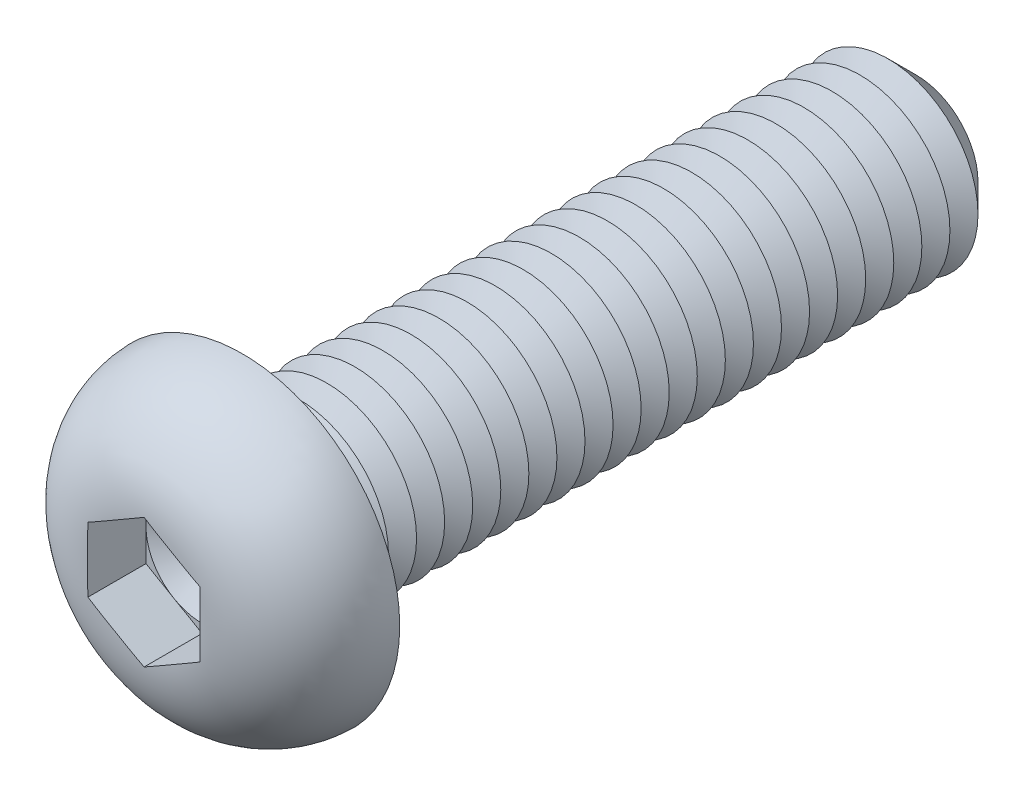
SolidWorks part; units mm, degrees
ref_plane "Front Plane" through (0, 0, 0) normal (0, 0, 1) x (1, 0, 0)
ref_plane "Top Plane" through (0, 0, 0) normal (0, 1, 0) x (1, 0, 0)
ref_plane "Right Plane" through (0, 0, 0) normal (1, 0, 0) x (0, 0, -1)
sketch "Sketch1" plane through (0, 0, 0) normal (1, 0, 0) x (0, 0, -1)
  line L0 (-47.9342, 0) -> (60.3146, 0) construction
sketch "Sketch2" plane through (0, 0, 0) normal (1, 0, 0) x (0, 0, -1)
  line L0 (0, 0) -> (-4.4, 0)
  line L1 (-47.9342, 0) -> (60.3146, 0) construction
  line L2 (-4.4, 0) -> (-4.4, 2.5011)
  line L3 (0, 7) -> (0, 0)
  arc A0 (-4.4, 2.5011) -> (0, 7) centre (0.1, 2.5011) cw
  dimension "D1" = 4.5
  dimension "D2" = 4.4
  dimension "D3" = 7
revolve "Revolve1" add sketch "Sketch2" angle 360 about L0
sketch "Sketch3" plane through (0, 0, 4.4) normal (0, 0, 1) x (1, 0, 0)
  line L1 (0, 2.8868) -> (-2.5, 1.4434)
  line L2 (-2.5, 1.4434) -> (-2.5, -1.4434)
  line L3 (-2.5, -1.4434) -> (0, -2.8868)
  line L4 (0, -2.8868) -> (2.5, -1.4434)
  line L5 (2.5, -1.4434) -> (2.5, 1.4434)
  line L6 (2.5, 1.4434) -> (0, 2.8868)
  circle A0 centre (0, 0) radius 2.5 construction
  dimension "D1" = 5
extrude "Cut-Extrude1" cut sketch "Sketch3" against normal blind 2.6
sketch "Sketch4" plane through (0, 0, 0) normal (0, 0, -1) x (-1, 0, 0)
  circle A0 centre (0, 0) radius 4
  dimension "D1" = 8
extrude "Boss-Extrude1" add sketch "Sketch4" along normal blind 30
chamfer "Chamfer1" distance 1.25 angle 45 1 edges at (-4, 0, -30)
sketch "Sketch5" plane through (0, 0, 0) normal (1, 0, 0) x (0, 0, -1)
  line L0 (1.25, 4) -> (2.5, 4)
  line L1 (28.75, 4) -> (0, 4) construction
  line L2 (2.5, 4) -> (1.875, 2.9175)
  line L3 (1.875, 2.9175) -> (1.25, 4)
  line L4 (0, -7) -> (0, 7) construction
  line L5 (28.75, 4) -> (0, 4) construction
  dimension "D1" = 1.25
  dimension "D2" = 1.25
revolve "Cut-Revolve1" cut sketch "Sketch5" angle 360 about L0
pattern_linear "LPattern1" count 22 spacing 1.25 along (0, 0, -1) of "Cut-Revolve1"
fillet "Fillet2" radius 0.5 1 edges at (4, 0, 0)
sketch "Sketch6" plane through (0, 0, 1.8) normal (0, 0, 1) x (1, 0, 0)
  line L0 (0, -2.8868) -> (2.5, -1.4434) construction
  circle A0 centre (0, 0) radius 2.5
extrude "Cut-Extrude2" cut sketch "Sketch6" against normal through all draft 60
